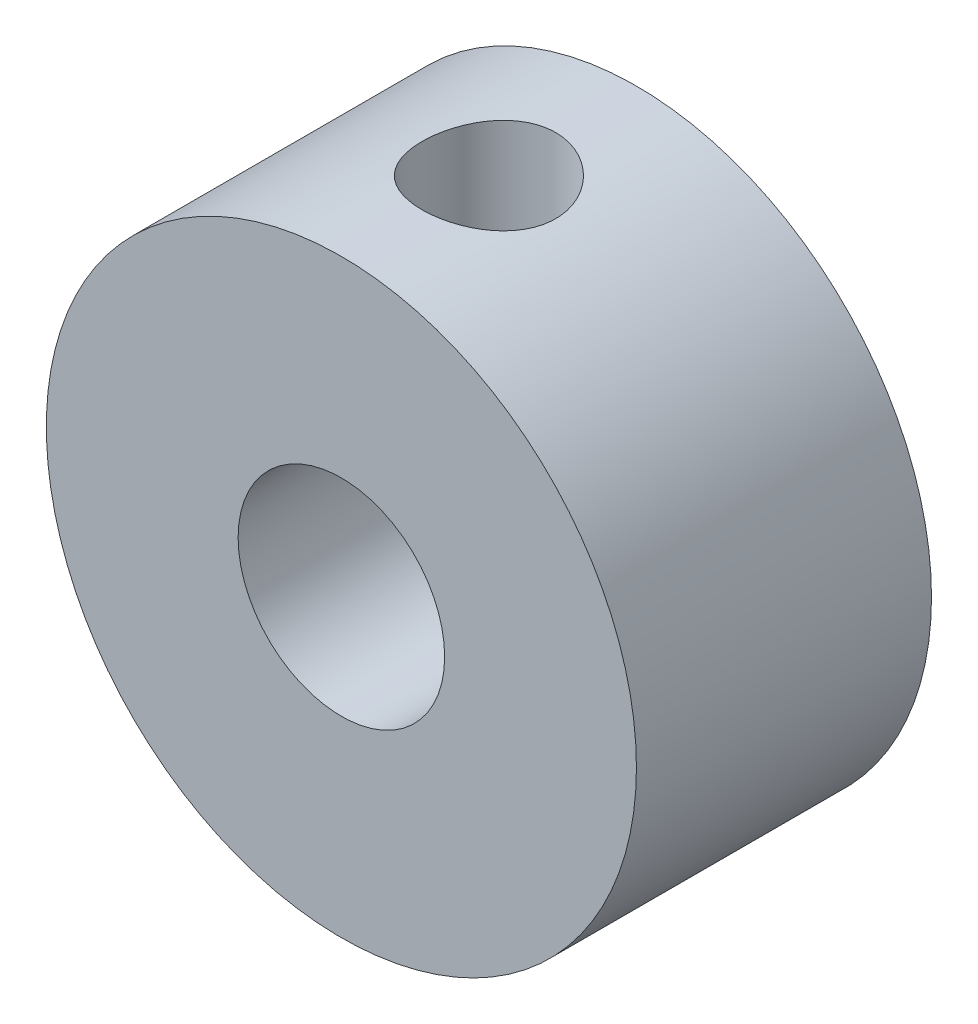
SolidWorks part; units mm, degrees
ref_plane "Plan de face" through (0, 0, 0) normal (0, 0, 1) x (1, 0, 0)
ref_plane "Plan de dessus" through (0, 0, 0) normal (0, 1, 0) x (1, 0, 0)
ref_plane "Plan de droite" through (0, 0, 0) normal (1, 0, 0) x (0, 0, -1)
sketch "Esquisse1" plane through (0, 0, 0) normal (0, 0, 1) x (1, 0, 0)
  circle A0 centre (0, 0) radius 15
  circle A1 centre (0, 0) radius 5.25
  dimension "D1" = 30
  dimension "D2" = 10.5
extrude "Extrusion1" add sketch "Esquisse1" along normal mid plane 15
ref_plane "Plan1" through (0, 15, 0) normal (0, 1, 0) x (-1, 0, 0)
hole_wizard "Trou taraudé M81" positions "Esquisse3" profile "Esquisse2" tap size "M8" standard "DIN"
sketch "Esquisse3" plane through (0, 15, 0) normal (0, 1, 0) x (-1, 0, 0)
  line L0 (-15, -7.5) -> (15, -7.5) construction
  point P0 (0, 0)
  dimension "D1" = 7.5
sketch "Esquisse2" plane through (0, 15, 0) normal (1, 0, 0) x (0, 0, 1)
  line L0 (0, 0) -> (0, 19.0429)
  line L1 (0, 19.0429) -> (3.4, 17)
  line L2 (3.4, 17) -> (3.4, 0)
  line L5 (3.4, 0) -> (0, 0)
  line L10 (0, 19.0429) -> (-3.4, 17) construction
  line L11 (0, -6.35) -> (0, 107.95) construction
  dimension "Diamètre du trou pour taraudage" = 6.8
  dimension "Profondeur du trou pour taraudage" = 17
  dimension "Angle de pointe" = 118
